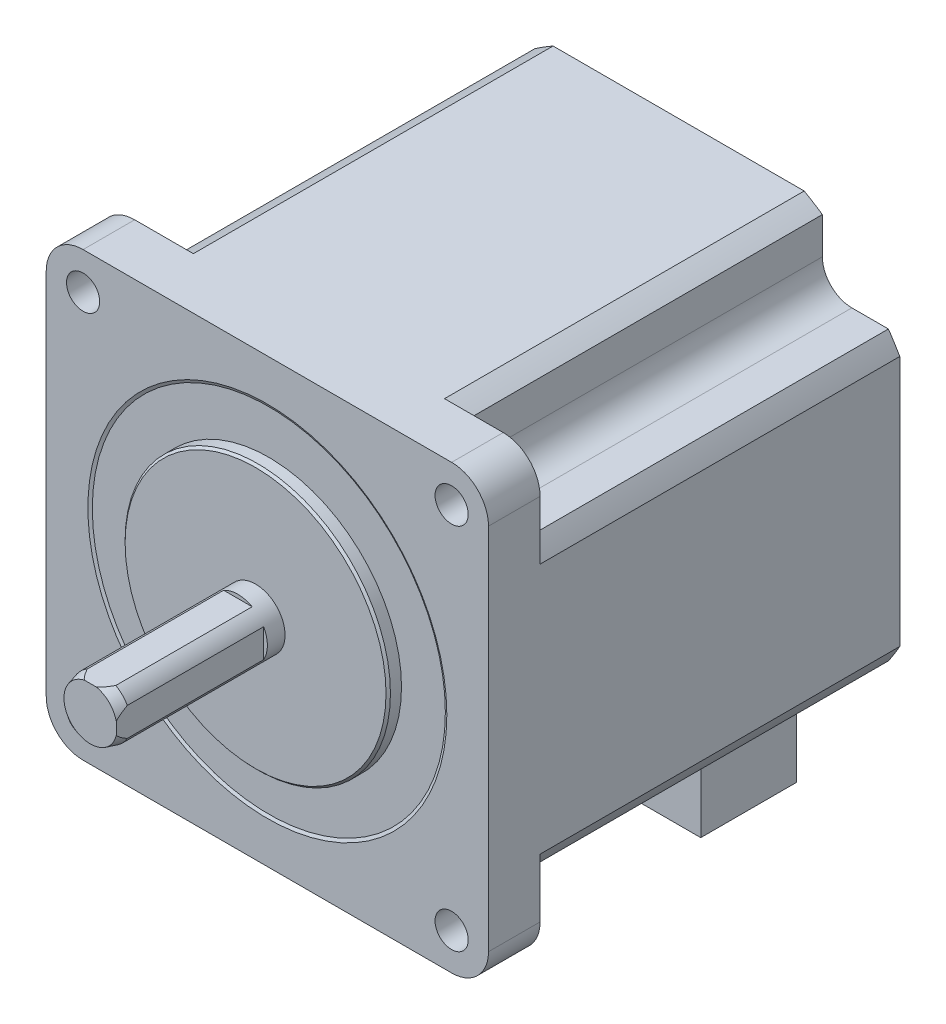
SolidWorks part; units mm, degrees
ref_plane "正面" through (0, 0, 0) normal (0, 0, 1) x (1, 0, 0)
ref_plane "平面" through (0, 0, 0) normal (0, 1, 0) x (1, 0, 0)
ref_plane "右側面" through (0, 0, 0) normal (1, 0, 0) x (0, 0, -1)
sketch "ｽｹｯﾁ1" plane through (0, 0, 0) normal (0, 0, 1) x (1, 0, 0)
  circle A0 centre (0, 0) radius 4
  dimension "D1" = 8
extrude "押し出し1" add sketch "ｽｹｯﾁ1" along normal blind 22.4
sketch "ｽｹｯﾁ2" plane through (0, 0, 0) normal (0, 0, -1) x (-1, 0, 0)
  circle A0 centre (0, 0) radius 18
  dimension "D1" = 36
extrude "押し出し2" add sketch "ｽｹｯﾁ2" along normal blind 1.6
sketch "ｽｹｯﾁ3" plane through (0, 0, -1.6) normal (0, 0, -1) x (-1, 0, 0)
  line L1 (-30, 30) -> (30, 30)
  line L2 (-30, 30) -> (-30, -30)
  line L3 (-30, -30) -> (30, -30)
  line L4 (30, 30) -> (30, -30)
  line L5 (-30, 30) -> (30, -30) construction
  line L6 (-30, -30) -> (30, 30) construction
  line L7 (25, 25) -> (-25, 25) construction
  line L8 (25, 25) -> (25, -25) construction
  line L9 (25, -25) -> (-25, -25) construction
  line L10 (-25, 25) -> (-25, -25) construction
  line L11 (25, 25) -> (-25, -25) construction
  line L12 (25, -25) -> (-25, 25) construction
  circle A0 centre (25, 25) radius 2.25
  circle A1 centre (-25, 25) radius 2.25
  circle A2 centre (25, -25) radius 2.25
  circle A3 centre (-25, -25) radius 2.25
  point P0 (0, 0)
  point P6 (0, 0)
  dimension "D3" = 50
  dimension "D4" = 50
  dimension "D6" = 4.5
  dimension "D1" = 60
  dimension "D2" = 60
extrude "押し出し3" add sketch "ｽｹｯﾁ3" along normal blind 7
fillet "Fillet1" radius 5 4 edges at (30, -30, -5.1) (-30, -30, -5.1) (-30, 30, -5.1) (30, 30, -5.1)
sketch "ｽｹｯﾁ4" plane through (0, 0, -8.6) normal (0, 0, -1) x (-1, 0, 0)
  line L0 (19.5, 19.5) -> (30, 19.5)
  line L1 (-19.5, 30) -> (19.5, 30)
  line L2 (-19.5, 30) -> (-19.5, 19.5)
  line L3 (-19.5, -30) -> (19.5, -30)
  line L4 (19.5, 30) -> (19.5, 19.5)
  line L5 (-19.5, 30) -> (19.5, -30) construction
  line L6 (-19.5, -30) -> (19.5, 30) construction
  line L7 (-30, 19.5) -> (-19.5, 19.5)
  line L8 (-30, 19.5) -> (-30, -19.5)
  line L9 (-30, -19.5) -> (-19.5, -19.5)
  line L10 (30, 19.5) -> (30, -19.5)
  line L11 (-30, 19.5) -> (30, -19.5) construction
  line L12 (-30, -19.5) -> (30, 19.5) construction
  line L13 (-19.5, -19.5) -> (-19.5, -30)
  line L14 (19.5, -19.5) -> (30, -19.5)
  line L15 (19.5, -19.5) -> (19.5, -30)
  circle A0 centre (0, 0) radius 34.5
  point P0 (0, 0)
  point P6 (0, 0)
  dimension "D5" = 69
  dimension "D1" = 39
  dimension "D2" = 60
  dimension "D3" = 60
  dimension "D4" = 39
extrude "押し出し4" add sketch "ｽｹｯﾁ4" along normal blind 48.8 contours L10 A0 L0 L4 L1 L2 L7 L8 L9 L13 L3 L15 L14
fillet "Fillet2" radius 4 4 edges at (19.5, -19.5, -33) (-19.5, -19.5, -33) (-19.5, 19.5, -33) (19.5, 19.5, -33)
sketch "Sketch1" plane through (0, -30, 0) normal (0, -1, 0) x (1, 0, 0)
  line L0 (17.0367, -57.4) -> (-17.0367, -57.4) construction
  line L1 (-16, -57.4) -> (16, -57.4)
  line L2 (-16, -57.4) -> (-16, -44.4)
  line L3 (-16, -44.4) -> (16, -44.4)
  line L4 (16, -57.4) -> (16, -44.4)
  dimension "D1" = 13
  dimension "D2" = 32
  dimension "D3" = 16
extrude "Extrude1" add sketch "Sketch1" along normal blind 10
chamfer "Chamfer1" distance 1.5 angle 15 1 edges at (4, 0, 22.4)
sketch "Sketch2" plane through (0, 0, 22.4) normal (0, 0, 1) x (1, 0, 0)
  line L1 (-4.7278, 5.1185) -> (3.4221, 5.1185)
  line L2 (-4.7278, 5.1185) -> (-4.7278, 3.5)
  line L3 (-4.7278, 3.5) -> (3.4221, 3.5)
  line L4 (3.4221, 5.1185) -> (3.4221, 3.5)
  line L5 (5.2412, 2.4413) -> (3.5, 2.4413)
  line L6 (5.2412, 2.4413) -> (5.2412, -4.2883)
  line L7 (5.2412, -4.2883) -> (3.5, -4.2883)
  line L8 (3.5, 2.4413) -> (3.5, -4.2883)
  dimension "D1" = 3.5
  dimension "D2" = 3.5
extrude "Extrude2" cut sketch "Sketch2" against normal blind 20
chamfer "Chamfer2" distance 0.3 angle 45 1 edges at (-18, 0, 0)
sketch "Sketch3" plane through (0, 0, -1.6) normal (0, 0, 1) x (1, 0, 0)
  circle A0 centre (0, 0) radius 18
  circle A1 centre (0, 0) radius 24.35
  dimension "D1" = 48.7
  dimension "D2" = 36
extrude "Extrude3" cut sketch "Sketch3" against normal blind 0.2
chamfer "Chamfer3" distance 0.2 distance2 0.4 1 edges at (24.35, 0, -1.8)
